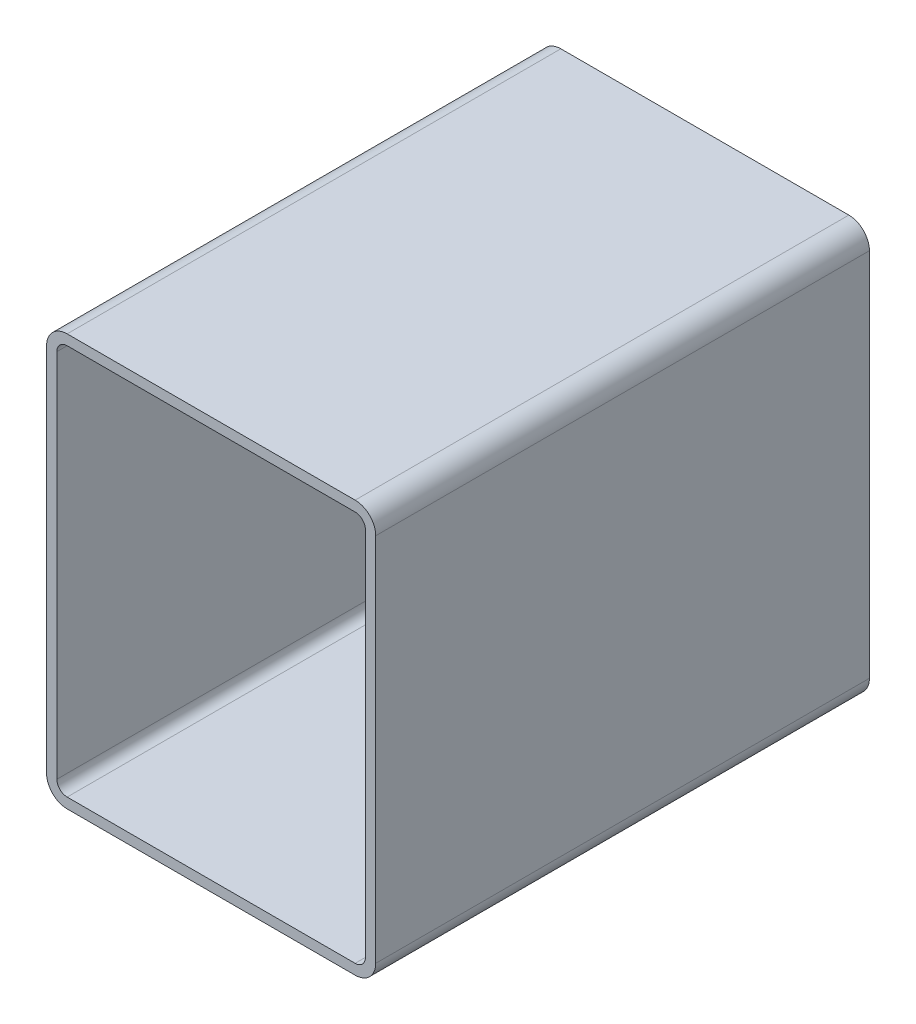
SolidWorks part; units mm, degrees
ref_plane "Front Plane" through (0, 0, 0) normal (0, 0, 1) x (1, 0, 0)
ref_plane "Top Plane" through (0, 0, 0) normal (0, 1, 0) x (1, 0, 0)
ref_plane "Right Plane" through (0, 0, 0) normal (1, 0, 0) x (0, 0, -1)
sketch "Sketch1" plane through (0, 0, 0) normal (0, 0, 1) x (1, 0, 0)
sketch_block_instance "HSS10x8x0.250-1"
sketch_block "HSS10x8x0.250"
extrude "Boss-Extrude1" add sketch "Sketch1" along normal blind 304.8
